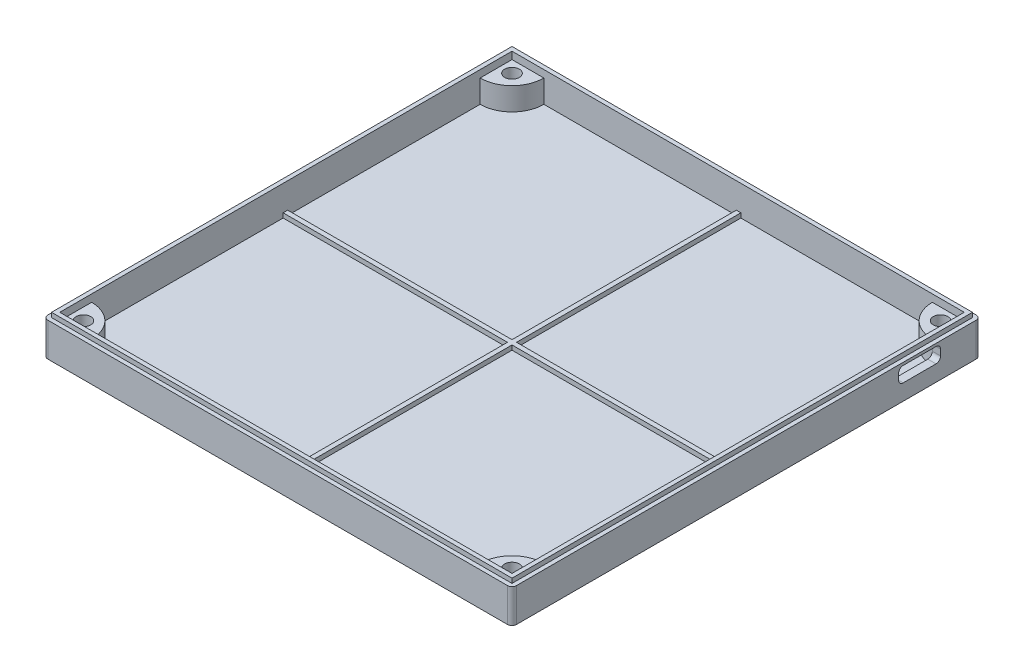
SolidWorks part; units mm, degrees
other "标注1"
sketch "草图15" plane through (103, 9.4, 103) normal (0.1592, 0.8984, 0.4092) x (0.9862, -0.1253, -0.1085)
other "标注2"
sketch "草图16" plane through (0, 9.4, 0) normal (-0.1306, 0.9904, -0.0454) x (0.9765, 0.1206, -0.1789)
other "标注3"
sketch "草图19" plane through (0, 9.4, 102.8) normal (-0.3128, 0.8638, 0.395) x (0.9476, 0.2555, 0.1917)
ref_plane "前视基准面" through (0, 0, 0) normal (0, 0, 1) x (1, 0, 0)
ref_plane "上视基准面" through (0, 0, 0) normal (0, 1, 0) x (1, 0, 0)
ref_plane "右视基准面" through (0, 0, 0) normal (1, 0, 0) x (0, 0, -1)
sketch "草图1" plane through (0, 0, 0) normal (0, 1, 0) x (1, 0, 0)
  line L1 (0, 0) -> (102.8, 0)
  line L2 (0, 0) -> (0, -102.8)
  line L3 (0, -102.8) -> (102.8, -102.8)
  line L4 (102.8, 0) -> (102.8, -102.8)
  dimension "D1" = 102.8
  dimension "D2" = 102.8
extrude "凸台-拉伸1" add sketch "草图1" along normal blind 8
sketch "草图2" plane through (0, 8, 0) normal (0, 1, 0) x (1, 0, 0)
  line L0 (0, 0) -> (0, -102.8) construction
  line L1 (1.8, -1.8) -> (101, -1.8)
  line L2 (1.8, -1.8) -> (1.8, -101)
  line L3 (1.8, -101) -> (101, -101)
  line L4 (101, -1.8) -> (101, -101)
  line L5 (102.8, 0) -> (0, 0) construction
  dimension "D1" = 99.2
  dimension "D2" = 99.2
  dimension "D3" = 1.8
  dimension "D4" = 1.8
extrude "切除-拉伸1" cut sketch "草图2" against normal offset from surface (6.6 mm away) 1.4
ref_plane "基准面1" through (51.4, 0, 0) normal (1, 0, 0) x (0, 0, -1)
ref_plane "基准面2" through (0, 0, 51.4) normal (0, 0, -1) x (-1, 0, 0)
sketch "草图10" plane through (0, 1.4, 0) normal (0, 1, 0) x (1, 0, 0)
  line L0 (1.8, -1.8) -> (101, -1.8) construction
  line L1 (51, -1.8) -> (52, -1.8)
  line L2 (51, -1.8) -> (51, -51)
  line L3 (51, -101) -> (52, -101)
  line L4 (52, -1.8) -> (52, -51)
  line L5 (101, -101) -> (1.8, -101) construction
  line L6 (1.8, -101) -> (1.8, -1.8) construction
  line L7 (1.8, -101) -> (1.8, -1.8) construction
  line L8 (1.8, -51) -> (51, -51)
  line L9 (1.8, -51) -> (1.8, -52)
  line L10 (1.8, -52) -> (51, -52)
  line L11 (101, -51) -> (101, -52)
  line L13 (51, -52) -> (51, -101)
  line L14 (52, -52) -> (52, -101)
  line L15 (52, -51) -> (101, -51)
  line L16 (52, -52) -> (101, -52)
  line L17 (101, -1.8) -> (101, -101) construction
  dimension "D1" = 49.2
  dimension "D2" = 1
  dimension "D3" = 49.2
  dimension "D4" = 1
extrude "凸台-拉伸7" add sketch "草图10" along normal blind 1
sketch "草图14" plane through (0, 0, 0) normal (0, -1, 0) x (1, 0, 0)
  line L1 (102.8, 0) -> (0, 0)
  line L2 (102.8, 0) -> (102.8, 102.8)
  line L3 (102.8, 102.8) -> (0, 102.8)
  line L4 (0, 0) -> (0, 102.8)
extrude "凸台-拉伸9" add sketch "草图14" along normal blind 0.4
sketch "草图17" plane through (0, 1.4, 0) normal (0, 1, 0) x (1, 0, 0)
  line L0 (1.8, -51) -> (1.8, -1.8) construction
  line L1 (1.8, -1.8) -> (51, -1.8) construction
  line L2 (1.8, -1.8) -> (1.8, -8.8)
  line L3 (1.8, -1.8) -> (8.8, -1.8)
  arc A0 (1.8, -8.8) -> (8.8, -1.8) centre (1.8, -1.8) ccw
  circle A1 centre (4.4, -4.4) radius 1.6
  dimension "D1" = 7
  dimension "D2" = 2.6
  dimension "D4" = 3.2
  dimension "D3" = 2.6
extrude "凸台-拉伸10" add sketch "草图17" along normal blind 5
sketch "草图18" plane through (0, -0.4, 0) normal (0, -1, 0) x (1, 0, 0)
  line L0 (0, 0) -> (102.8, 0) construction
  line L1 (1.6533, 5.9934) -> (1.6467, 2.818)
  line L2 (1.6467, 2.818) -> (4.3934, 1.2246)
  line L3 (4.3934, 1.2246) -> (7.1467, 2.8066)
  line L4 (7.1467, 2.8066) -> (7.1533, 5.982)
  line L5 (7.1533, 5.982) -> (4.4066, 7.5754)
  line L6 (4.4066, 7.5754) -> (1.6533, 5.9934)
  line L7 (0, 102.8) -> (0, 0) construction
  circle A1 centre (4.4, 4.4) radius 2.75 construction
  dimension "D1" = 4.4
  dimension "D2" = 4.4
  dimension "D3" = 5.5
extrude "切除-拉伸6" cut sketch "草图18" against normal blind 2.5
mirror "镜向1" about plane through (51.4, 0, 0) normal (1, 0, 0) of "切除-拉伸6", "凸台-拉伸10"
sketch "草图21" plane through (102.8, 0, 0) normal (1, 0, 0) x (0, 0, -1)
  line L1 (-9.8, 6.4) -> (-17, 6.4)
  line L2 (-8.8, 5.4) -> (-8.8, 4.1)
  line L3 (-9.8, 3.1) -> (-17, 3.1)
  line L4 (-18, 5.4) -> (-18, 4.1)
  line L5 (-102.8, 8) -> (0, 8) construction
  line L7 (0, 8) -> (0, -0.4) construction
  arc A0 (-17, 3.1) -> (-18, 4.1) centre (-17, 4.1) cw
  arc A1 (-18, 5.4) -> (-17, 6.4) centre (-17, 5.4) cw
  arc A2 (-9.8, 6.4) -> (-8.8, 5.4) centre (-9.8, 5.4) cw
  arc A3 (-9.8, 3.1) -> (-8.8, 4.1) centre (-9.8, 4.1) ccw
  dimension "D5" = 1
  dimension "D1" = 3.3
  dimension "D2" = 1.6
  dimension "D3" = 9.2
  dimension "D4" = 8.8
extrude "切除-拉伸7" cut sketch "草图21" against normal up to next and the other way through all
sketch "草图22" plane through (0, 8, 0) normal (0, 1, 0) x (1, 0, 0)
  line L0 (0, 0) -> (0, -102.8) construction
  line L1 (0.9, -0.9) -> (101.9, -0.9)
  line L2 (0.9, -0.9) -> (0.9, -101.9)
  line L3 (0.9, -101.9) -> (101.9, -101.9)
  line L4 (101.9, -0.9) -> (101.9, -101.9)
  line L5 (102.8, 0) -> (0, 0) construction
  line L6 (0, -102.8) -> (102.8, -102.8) construction
  line L7 (102.8, -102.8) -> (102.8, 0) construction
  line L9 (0, 0) -> (102.8, 0)
  line L10 (0, 0) -> (0, -102.8)
  line L11 (0, -102.8) -> (102.8, -102.8)
  line L12 (102.8, 0) -> (102.8, -102.8)
  dimension "D1" = 0.9
  dimension "D2" = 0.9
  dimension "D3" = 0.9
  dimension "D4" = 0.9
extrude "切除-拉伸9" cut sketch "草图22" against normal blind 1
fillet "圆角1" radius 1 4 edges at (0, 3.3, 0) (102.8, 3.3, 0) (102.8, 3.3, 102.8) (0, 3.3, 102.8)
mirror "镜向2" about plane through (0, 0, 51.4) normal (0, 0, -1) of "镜向1", "凸台-拉伸10", "切除-拉伸6"
